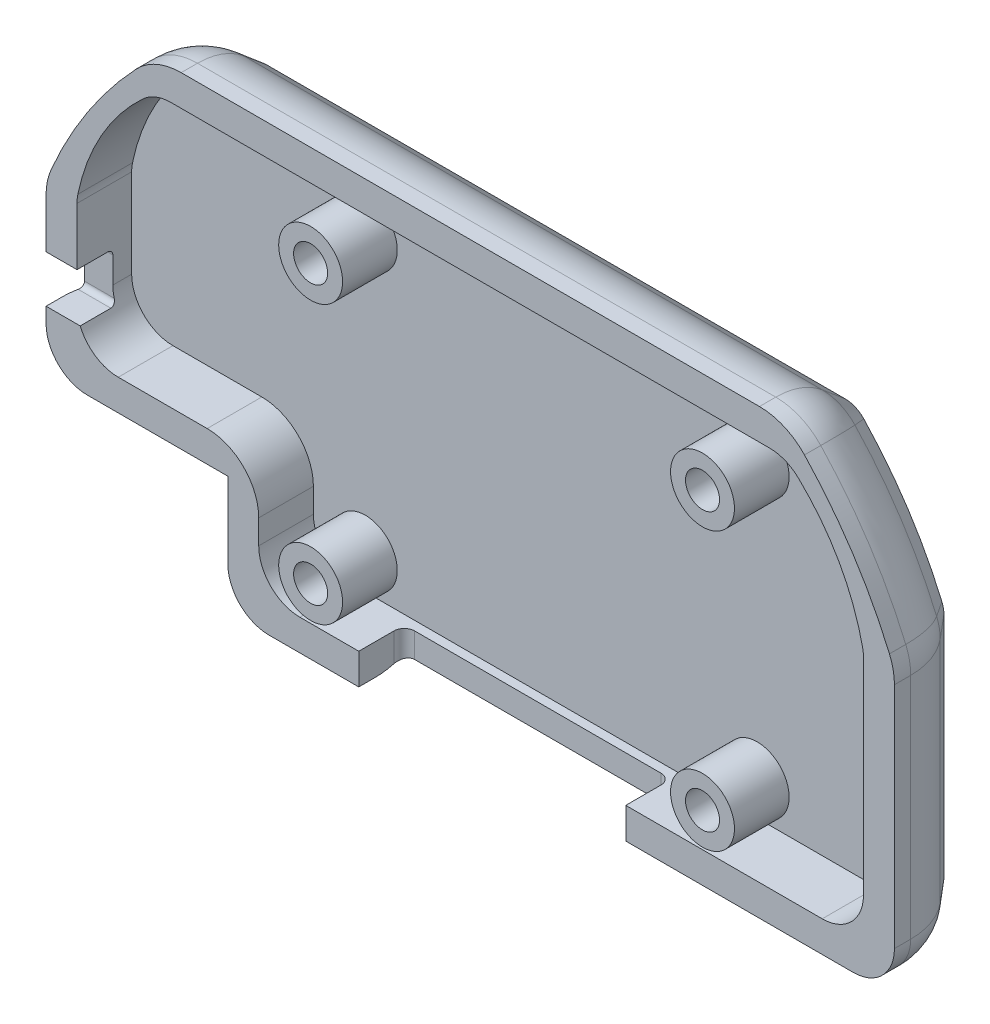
SolidWorks part; units mm, degrees
ref_plane "Alzado" through (0, 0, 0) normal (0, 0, 1) x (1, 0, 0)
ref_plane "Planta" through (0, 0, 0) normal (0, 1, 0) x (1, 0, 0)
ref_plane "Vista lateral" through (0, 0, 0) normal (1, 0, 0) x (0, 0, -1)
sketch "Croquis2" plane through (0, 0, 0) normal (0, 0, 1) x (1, 0, 0)
  line L0 (-43.6, 25.3285) -> (-43.6, 41.313)
  line L1 (-32.9688, 56.9561) -> (28.051, 56.9561)
  line L2 (38.6624, 41.313) -> (38.6624, 25.3285)
  line L7 (-43.6, 25.3285) -> (-25.98, 25.3285)
  line L8 (-25.98, 25.3285) -> (-25.98, 13.9787)
  line L9 (-25.98, 13.9787) -> (38.6624, 13.9787)
  line L10 (38.6624, 13.9787) -> (38.6624, 25.3285)
  arc A0 (-43.6, 41.313) -> (-32.9688, 56.9561) centre (-3.7394, 25.6575) cw
  arc A1 (28.051, 56.9561) -> (38.6624, 41.313) centre (-1.2097, 25.6867) cw
extrude "Saliente-Extruir1" add sketch "Croquis2" along normal blind 8.3
sketch "Croquis3" plane through (0, 0, 8.3) normal (0, 0, 1) x (1, 0, 0)
  line L0 (35.6624, 41.313) -> (35.6624, 28.3285)
  line L1 (-40.6, 28.3285) -> (-22.98, 28.3285)
  line L2 (-40.6, 41.313) -> (-40.6, 28.3285)
  line L7 (-22.98, 28.3285) -> (-22.98, 16.9787)
  line L8 (-22.98, 16.9787) -> (35.6624, 16.9787)
  line L11 (35.6624, 16.9787) -> (35.6624, 28.3285)
  line L17 (-32.9688, 53.9561) -> (28.0724, 53.9561)
  arc A0 (-40.6, 41.313) -> (-32.9688, 53.9561) centre (-19.994, 37.5001) cw
  arc A1 (28.0724, 53.9561) -> (35.6624, 41.313) centre (14.5103, 37.2147) cw
  point P1 (0, 0)
  point P7 (0, 0)
  point P8 (0, 0)
  point P12 (0, 0)
extrude "Cortar-Extruir1" cut sketch "Croquis3" against normal blind 5.3
fillet "Redondeo1" radius 4 10 edges at (35.6624, 16.9787, 5.65) (35.6624, 41.313, 5.65) (28.0724, 53.9561, 5.65) (-22.98, 16.9787, 5.65) (-40.6, 28.3285, 5.65) (-32.9688, 53.9561, 5.65) (-40.6, 41.313, 5.65) (38.6624, 13.9787, 4.15) (-25.98, 13.9787, 4.15) (-43.6, 25.3285, 4.15)
fillet "Redondeo2" radius 6 4 edges at (-43.6, 41.313, 4.15) (-32.9688, 56.9561, 4.15) (38.6624, 41.313, 4.15) (28.051, 56.9561, 4.15)
chamfer "Chaflán1" distance 3.5 angle 50 15 edges at (27.9535, 56.4654, 0) (-2.4607, 56.9561, 0) (-32.872, 56.4667, 0) (-39.5452, 49.1503, 0) (-43.478, 41.3361, 0) (-43.6, 34.7305, 0) (-42.4285, 26.5001, 0) (-32.79, 25.3285, 0) (-25.98, 21.6536, 0) (-24.8085, 15.1503, 0) (6.3412, 13.9787, 0) (37.4908, 15.1503, 0) (38.6624, 29.0568, 0) (38.5409, 41.3362, 0) (34.6182, 49.1458, 0)
fillet "Redondeo3" radius 7 15 edges at (-42.4285, 26.5001, 4.1711) (-24.8085, 15.1503, 4.1711) (-32.79, 25.3285, 4.1711) (-25.98, 21.6536, 4.1711) (-43.6, 34.7305, 4.1711) (-43.478, 41.3361, 4.1711) (-39.5452, 49.1503, 4.1711) (-32.872, 56.4667, 4.1711) (27.9535, 56.4654, 4.1711) (-2.4607, 56.9561, 4.1711) (38.5409, 41.3362, 4.1711) (34.6182, 49.1458, 4.1711) (38.6624, 29.0568, 4.1711) (37.4908, 15.1503, 4.1711) (6.3412, 13.9787, 4.1711)
sketch "Croquis4" plane through (0, 0, 0) normal (0, 0, -1) x (-1, 0, 0)
  circle A8 centre (-20.0535, 20.2867) radius 2.775
  circle A10 centre (-20.0535, 47.1867) radius 2.775
  circle A11 centre (17.9465, 47.2217) radius 2.775
  circle A12 centre (17.9465, 20.3217) radius 2.755
  dimension "D2" = 26.9
extrude "Cortar-Extruir2" cut sketch "Croquis4" against normal blind 5
sketch "Croquis7" plane through (-23.5317, 0, -19.7454) normal (-0.766, 0, -0.6428) x (-0.6428, 0, 0.766)
sketch "Croquis8" plane through (-43.6, 0, 0) normal (-1, 0, 0) x (0, 0, 1)
  line L0 (8.6236, 35.3575) -> (8.6236, 30.7915)
  line L4 (4.8292, 35.3575) -> (4.8292, 30.7915)
  line L5 (4.8292, 30.7915) -> (8.6236, 30.7915)
  line L6 (8.6236, 35.3575) -> (4.8292, 35.3575)
extrude "Cortar-Extruir3" cut sketch "Croquis8" against normal blind 5
sketch "Croquis9" plane through (-25.98, 0, 0) normal (-1, 0, 0) x (0, 0, 1)
  line L0 (8.4088, 23.1178) -> (8.4088, 17.9733)
  line L1 (8.4088, 23.1178) -> (4.7271, 23.1178)
  line L2 (4.7271, 23.1178) -> (4.7935, 18.0212)
  line L3 (4.7935, 18.0212) -> (8.4088, 17.9733)
fillet "Redondeo8" radius 5 1 edges at (-22.98, 28.3285, 5.65)
sketch "Croquis12" plane through (0, 0, 3) normal (0, 0, 1) x (1, 0, 0)
  circle A1 centre (-17.9465, 47.2217) radius 3.1
  circle A2 centre (-17.9465, 47.2217) radius 1.65
  circle A3 centre (-17.9465, 20.3217) radius 1.65
  circle A4 centre (-17.9465, 20.3217) radius 3.1
  circle A5 centre (20.0535, 20.2867) radius 1.65
  circle A6 centre (20.0535, 20.2867) radius 3.1
  circle A7 centre (20.0535, 47.1867) radius 1.65
  circle A8 centre (20.0535, 47.1867) radius 3.1
  circle A10 centre (20.0535, 20.2867) radius 2.775 construction
  circle A11 centre (20.0535, 47.1867) radius 2.775 construction
  circle A14 centre (-17.9465, 47.2217) radius 2.775 construction
  circle A15 centre (-17.9465, 20.3217) radius 2.755 construction
extrude "Saliente-Extruir4" add sketch "Croquis12" along normal up to surface (5.3 mm away)
fillet "Redondeo9" radius 0.5 2 edges at (-41.8165, 30.7915, 4.8292) (-41.9701, 35.3575, 4.8292)
sketch "Croquis14" plane through (0, 16.9787, 0) normal (0, 1, 0) x (1, 0, 0)
  line L1 (-13.279, -9.379) -> (-13.2784, -3.8865)
  line L2 (-13.2784, -3.8865) -> (12.6103, -3.8865)
  line L3 (12.6103, -3.8865) -> (12.6103, -11.0043)
  line L4 (12.6103, -11.0043) -> (-13.279, -9.379)
extrude "Cortar-Extruir4" cut sketch "Croquis14" against normal blind 10
fillet "Redondeo10" radius 1 2 edges at (-13.2784, 15.7781, 3.8865) (12.6103, 15.7781, 3.8865)
